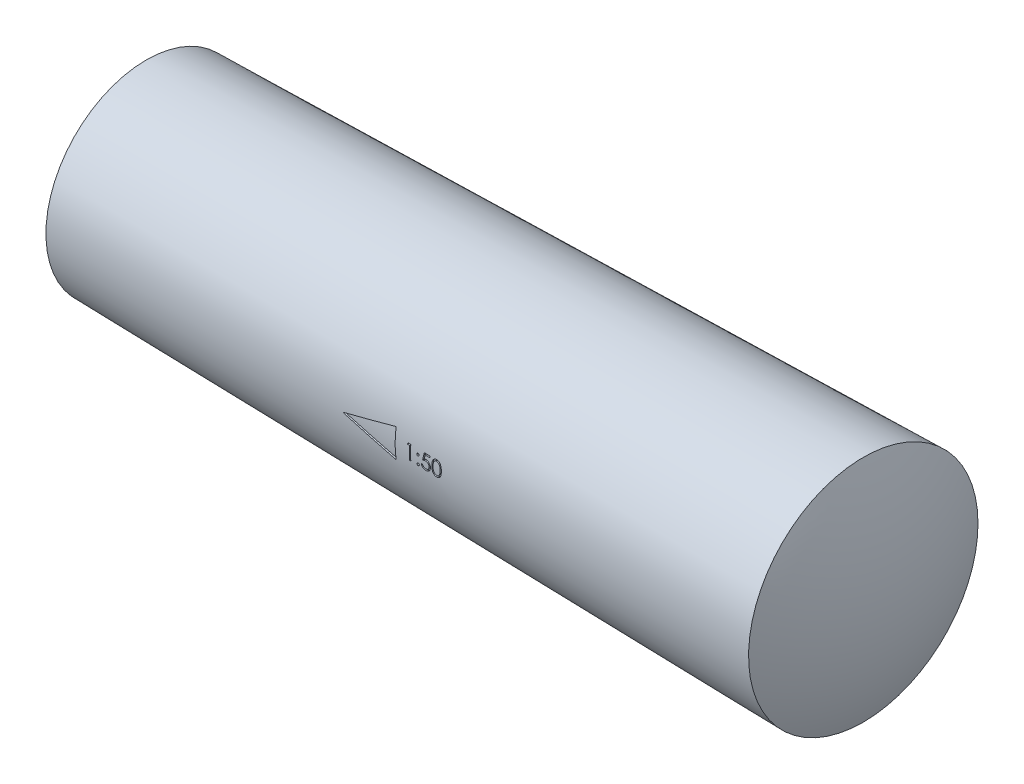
SolidWorks part; units mm, degrees
ref_plane "Front Plane" through (0, 0, 0) normal (0, 0, 1) x (1, 0, 0)
ref_plane "Top Plane" through (0, 0, 0) normal (0, 1, 0) x (1, 0, 0)
ref_plane "Right Plane" through (0, 0, 0) normal (1, 0, 0) x (0, 0, -1)
sketch "Sketch1" plane through (0, 0, 0) normal (1, 0, 0) x (0, 0, -1)
  circle A0 centre (0, 0) radius 7
  dimension "D1" = 14
extrude "Extrude1" add sketch "Sketch1" along normal mid plane 50
draft "Draft1" type of draft neutral plane draft angle 1.146 faces to draft 1 parameters "D1"=1.146
sketch "Sketch2" plane through (0, 0, 0) normal (0, 0, 1) x (1, 0, 0)
  line L0 (-25, 0) -> (-25, 7)
  line L1 (-25, 7) -> (-25, -7) construction
  line L2 (-25, 0) -> (-26.6, 0)
  line L3 (-26.6, 0) -> (-26.6, -7.5) construction
  line L4 (25, 0) -> (25, 8)
  line L5 (25, -8) -> (25, 8) construction
  line L6 (25, 0) -> (26.6, 0)
  line L7 (26.6, 0) -> (26.6, -7.5) construction
  line L8 (-25, -7) -> (25, -8) construction
  arc A0 (-26.6, 0) -> (-25, 7) centre (-10.4875, 0) cw
  arc A1 (26.6, 0) -> (25, 8) centre (5.7998, 0) ccw
  point P14 (0, -7.5)
revolve "Revolve1" add sketch "Sketch2" angle 360 about L2
sketch "Sketch5" plane through (0, 0, 0) normal (0, 0, 1) x (1, 0, 0)
  line L0 (0, 7.5) -> (0, -7.5) construction
  line L1 (25, 8) -> (-25, 7) construction
  line L2 (-25, -7) -> (25, -8) construction
ref_plane "Plane2" through (0, 0, 0) normal (-0.02, 0, 0.9998) x (0.9998, 0, 0.02)
sketch "Sketch6" plane through (0, 0, 0) normal (-0.02, 0, 0.9998) x (0.9998, 0, 0.02)
  line L0 (0, 0) -> (0, 1)
  line L1 (0, 7.5) -> (0, -7.5) construction
  line L2 (0, 1) -> (-3.7321, 0)
  line L3 (-3.7321, 0) -> (0, -1)
  line L4 (0, -1) -> (0, 0)
  line L5 (0, -0.5) -> (4, -0.5) construction
  text T0 "1:50" font "Century Gothic" height 1
  dimension "D1" = 2
  dimension "D2" = 30
  dimension "D3" = 4
wrap "Wrap2" sketch "Sketch6" wrap type deboss source sketch "Sketch6" thickness 0.1 parameters "D1"=0.1
equation "\"D2@Sketch2\" = \"D1@Sketch2\""
